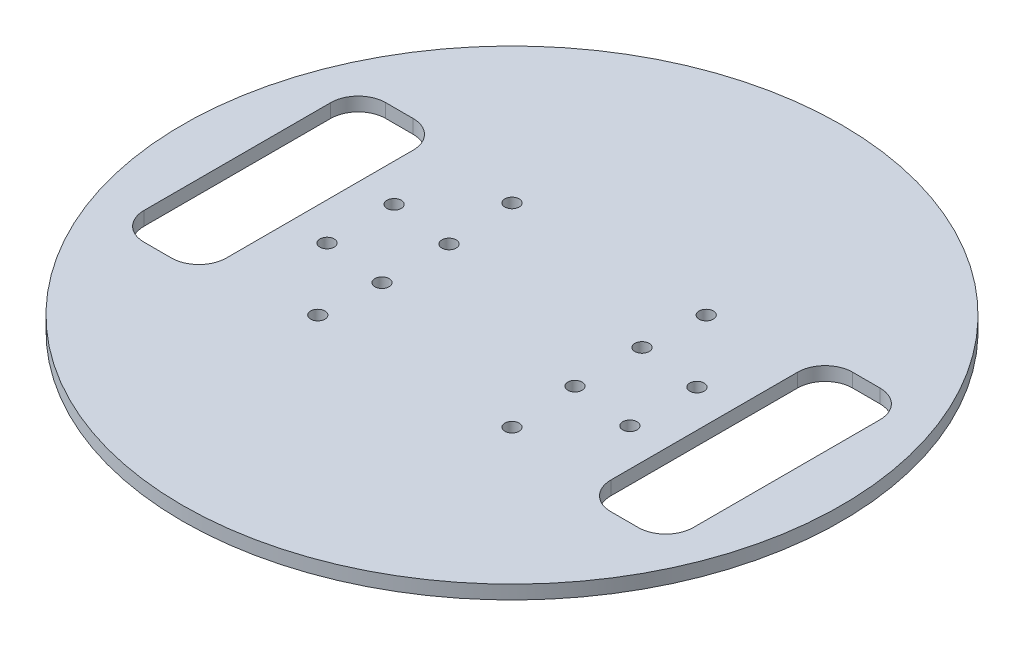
SolidWorks part; units mm, degrees
ref_plane "Front" through (0, 0, 0) normal (0, 0, 1) x (1, 0, 0)
ref_plane "Top" through (0, 0, 0) normal (0, 1, 0) x (1, 0, 0)
ref_plane "Right" through (0, 0, 0) normal (1, 0, 0) x (0, 0, -1)
sketch "Sketch1" plane through (0, 0, 0) normal (0, 1, 0) x (1, 0, 0)
  line L0 (0, 152.4) -> (0, -152.4) construction
  line L1 (-101.6, 55.88) -> (-114.3, 55.88)
  line L2 (-127, 43.18) -> (-127, -43.18)
  line L3 (-114.3, -55.88) -> (-101.6, -55.88)
  line L4 (-88.9, -43.18) -> (-88.9, 43.18)
  line L5 (88.9, -43.18) -> (88.9, 43.18)
  line L6 (114.3, -55.88) -> (101.6, -55.88)
  line L7 (127, 43.18) -> (127, -43.18)
  line L8 (101.6, 55.88) -> (114.3, 55.88)
  line L9 (-152.4, 0) -> (152.4, 0) construction
  line L10 (-107.95, 55.88) -> (-107.95, -55.88) construction
  line L11 (-107.95, 0) -> (-92.525, 0)
  line L12 (-92.525, 0) -> (-81.925, 0)
  line L13 (-81.925, 0) -> (-81.925, -6.3164) construction
  line L14 (-81.925, -6.3164) -> (-81.925, 11.4587) construction
  line L15 (-71.6063, 0) -> (-43.0313, 0)
  line L16 (-43.0313, 0) -> (-43.0313, -19.4149) construction
  line L17 (-43.0313, -19.4149) -> (-43.0313, 26.6429) construction
  line L18 (-71.6063, 0) -> (-71.6063, 26.6429) construction
  line L19 (-71.6063, 26.6429) -> (-71.6063, -21.5597) construction
  line L20 (107.95, 55.88) -> (107.95, -55.88) construction
  line L25 (39.8563, 0) -> (39.8563, 19.4149) construction
  line L26 (39.8563, 19.4149) -> (39.8563, -26.6429) construction
  line L27 (68.4313, 0) -> (68.4313, -26.6429) construction
  line L28 (68.4313, -26.6429) -> (68.4313, 21.5597) construction
  line L29 (68.4313, 0) -> (39.8563, 0)
  circle A0 centre (0, 0) radius 152.4
  circle A1 centre (-43.0313, 13.9125) radius 3.302
  circle A2 centre (-43.0313, -17.0875) radius 3.302
  circle A3 centre (-71.6063, 17.0875) radius 3.302
  circle A4 centre (-71.6063, -13.9125) radius 3.302
  arc A5 (-114.3, 55.88) -> (-127, 43.18) centre (-114.3, 43.18) ccw
  arc A6 (-88.9, 43.18) -> (-101.6, 55.88) centre (-101.6, 43.18) ccw
  arc A7 (-101.6, -55.88) -> (-88.9, -43.18) centre (-101.6, -43.18) ccw
  arc A8 (-127, -43.18) -> (-114.3, -55.88) centre (-114.3, -43.18) ccw
  circle A9 centre (43.0313, -13.9125) radius 3.302
  circle A10 centre (43.0313, 17.0875) radius 3.302
  circle A11 centre (71.6063, -17.0875) radius 3.302
  circle A12 centre (71.6063, 13.9125) radius 3.302
  arc A13 (101.6, 55.88) -> (88.9, 43.18) centre (101.6, 43.18) ccw
  arc A14 (127, 43.18) -> (114.3, 55.88) centre (114.3, 43.18) ccw
  arc A15 (114.3, -55.88) -> (127, -43.18) centre (114.3, -43.18) ccw
  arc A16 (88.9, -43.18) -> (101.6, -55.88) centre (101.6, -43.18) ccw
  point P40 (-127, 55.88)
  point P43 (-88.9, 55.88)
  point P46 (-88.9, -55.88)
  point P49 (-127, -55.88)
  point P70 (88.9, 55.88)
  point P73 (127, 55.88)
  point P76 (127, -55.88)
  point P79 (88.9, -55.88)
  dimension "D1" = 88.9
  dimension "D2" = 38.1
  dimension "D4" = 304.8
  dimension "D3" = 13.9125
  dimension "D7" = 17.0875
  dimension "D9" = 17.0875
  dimension "D10" = 13.9125
  dimension "D13" = 17.0875
  dimension "D14" = 28.575
  dimension "D15" = 13.9125
  dimension "D16" = 30.9999
  dimension "D17" = 28.575
  dimension "D12" = 36.3437
  dimension "D18" = 12.7
  dimension "D19" = 12.7
  dimension "D20" = 6.604
  dimension "D21" = 6.604
  dimension "D22" = 6.604
  dimension "D23" = 6.604
  dimension "D24" = 6.604
  dimension "D25" = 6.604
  dimension "D26" = 6.604
  dimension "D27" = 6.604
  dimension "D5" = 55.88
  dimension "D6" = 55.88
  dimension "D8" = 28.575
  dimension "D11" = 36.3437
extrude "Extrude1" add sketch "Sketch1" along normal blind 6.35
sketch "Sketch2" plane through (0, 6.35, 0) normal (0, 1, 0) x (1, 0, 0)
  line L0 (0, 0) -> (-44.9013, 44.9013)
  line L1 (0, 0) -> (0, 114.3) construction
  line L2 (0, 114.3) -> (0, -114.3) construction
  line L3 (0, 0) -> (-114.3, 0) construction
  line L4 (-114.3, 0) -> (114.3, 0) construction
  circle A1 centre (-44.9013, 44.9013) radius 3.302
  circle A2 centre (44.9013, 44.9013) radius 3.302
  circle A3 centre (44.9013, -44.9013) radius 3.302
  circle A4 centre (-44.9013, -44.9013) radius 3.302
  dimension "D1" = 45
  dimension "D2" = 63.5
extrude "Extrude3" cut sketch "Sketch2" against normal through all contours A4 | A1 | A2 | A3
